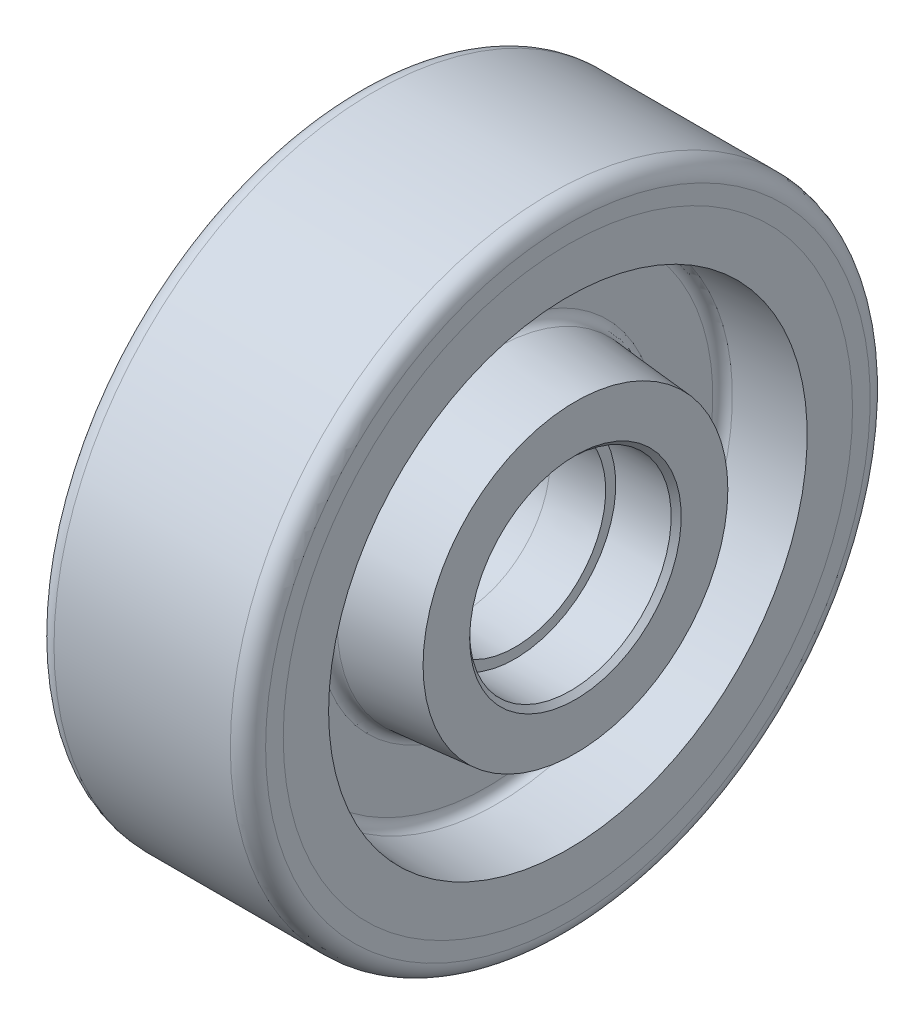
SolidWorks part; units mm, degrees
ref_plane "前视基准面" through (0, 0, 0) normal (0, 0, 1) x (1, 0, 0)
ref_plane "上视基准面" through (0, 0, 0) normal (0, 1, 0) x (1, 0, 0)
ref_plane "右视基准面" through (0, 0, 0) normal (1, 0, 0) x (0, 0, -1)
sketch "草图1" plane through (0, 0, 0) normal (0, 1, 0) x (1, 0, 0)
  line L0 (22.5, 30.25) -> (6.8257, 31.6213)
  line L1 (-24.8072, 0) -> (24.8072, 0) construction
  line L2 (6.8953, 46.7608) -> (21, 47.5)
  line L3 (-21.5, 20) -> (-10.5, 20)
  line L4 (-22.5, 21) -> (-21.5, 20)
  line L5 (10.5, 20) -> (21.5, 20)
  line L6 (-5, 33.6137) -> (-5, 44.7635)
  line L7 (5, 33.6137) -> (5, 44.7635)
  line L8 (-22.5, 30.25) -> (-6.8257, 31.6213)
  line L9 (21, 56.5) -> (0, 57.6006)
  line L10 (-21, 56.5) -> (0, 57.6006)
  line L11 (-6.8953, 46.7608) -> (-21, 47.5)
  line L12 (22.5, 21) -> (22.5, 30.25)
  line L13 (21.5, 20) -> (22.5, 21)
  line L14 (-22.5, 30.25) -> (-22.5, 21)
  line L15 (-21, 47.5) -> (-21, 56.5)
  line L16 (21, 47.5) -> (21, 56.5)
  line L17 (10.5, 18) -> (10.5, 20)
  line L18 (-10.5, 20) -> (-10.5, 18)
  line L19 (0, 17.4497) -> (10.5, 18)
  line L20 (0, 17.4497) -> (-10.5, 18)
  arc A0 (5, 33.6137) -> (6.8257, 31.6213) centre (7, 33.6137) ccw
  arc A1 (6.8953, 46.7608) -> (5, 44.7635) centre (7, 44.7635) ccw
  arc A2 (-5, 44.7635) -> (-6.8953, 46.7608) centre (-7, 44.7635) ccw
  arc A3 (-6.8257, 31.6213) -> (-5, 33.6137) centre (-7, 33.6137) ccw
revolve "旋转1" add sketch "草图1" angle 360 about L1
sketch "草图2" plane through (0, 0, 0) normal (0, 1, 0) x (1, 0, 0)
  line L0 (-24.8072, 0) -> (24.8072, 0) construction
  line L1 (-17.5, 63.5) -> (17.5, 63.5)
  line L2 (21, 56.5) -> (0, 57.6006)
  line L3 (-21, 56.5) -> (0, 57.6006)
  line L4 (-21, 56.5) -> (-21, 60)
  line L5 (21, 56.5) -> (21, 60)
  arc A0 (-17.5, 63.5) -> (-21, 60) centre (-17.5, 60) ccw
  arc A1 (21, 60) -> (17.5, 63.5) centre (17.5, 60) ccw
revolve "旋转2" add sketch "草图2" angle 360 about L0
